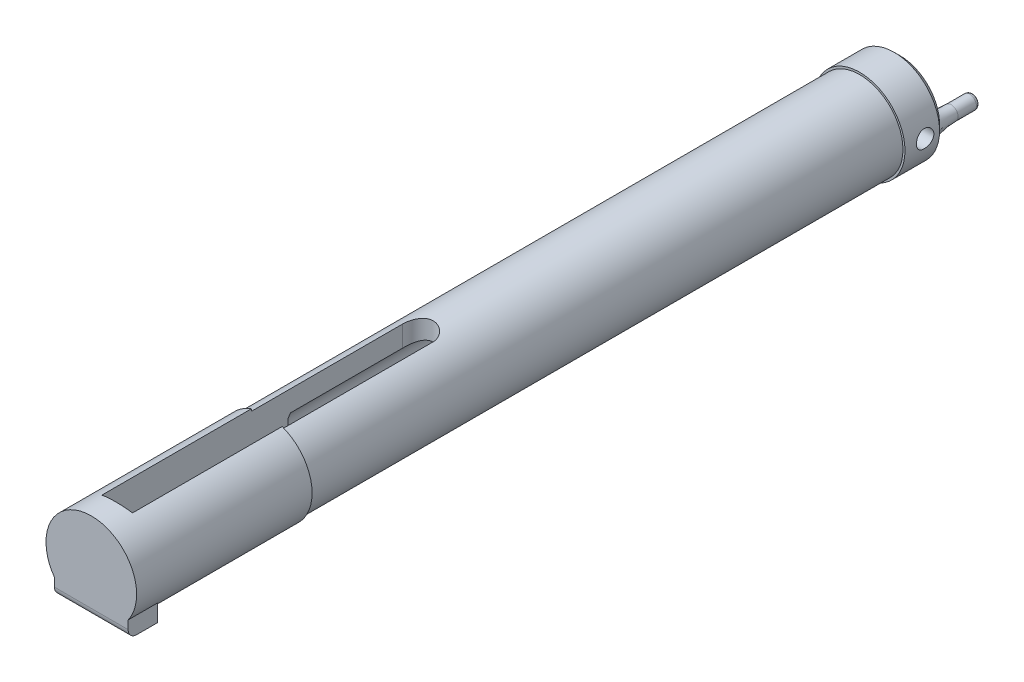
SolidWorks part; units mm, degrees
ref_plane "Спереди" through (0, 0, 0) normal (0, 0, 1) x (1, 0, 0)
ref_plane "Сверху" through (0, 0, 0) normal (0, 1, 0) x (1, 0, 0)
ref_plane "Справа" through (0, 0, 0) normal (1, 0, 0) x (0, 0, -1)
sketch "Эскиз1" plane through (0, 0, 0) normal (1, 0, 0) x (0, 0, -1)
  line L0 (-107.9741, 0) -> (5.4684, 0) construction
  line L1 (-82.296, 0) -> (-82.296, 3.0321)
  line L2 (-81.8991, 3.429) -> (0, 3.429)
  line L3 (0, 3.429) -> (0, 5.4547)
  line L4 (-0.7937, 6.2484) -> (-5.5562, 6.2484)
  line L5 (-5.5562, 6.2484) -> (-5.5562, 5.969)
  line L6 (-5.5562, 5.969) -> (-87.3125, 5.969)
  line L7 (-87.3125, 5.969) -> (-87.3125, 6.2484)
  line L8 (-87.3125, 6.2484) -> (-111.506, 6.2484)
  line L9 (-111.506, 6.2484) -> (-111.506, 0)
  line L10 (-111.506, 0) -> (-82.296, 0)
  line L11 (0, 5.4547) -> (-0.7937, 6.2484)
  line L12 (-82.296, 3.0321) -> (-81.8991, 3.429)
  point P4 (-82.296, 3.429)
  point P7 (0, 6.2484)
  dimension "D1" = 6.858
  dimension "D2" = 11.938
  dimension "D3" = 12.4968
  dimension "D4" = 5.5562
  dimension "D5" = 82.296
  dimension "D6" = 87.3125
  dimension "D7" = 111.506
revolve "Повернуть1" add sketch "Эскиз1" angle 360 about L0
sketch "Эскиз2" plane through (0, 0, 0) normal (1, 0, 0) x (0, 0, -1)
  line L0 (-111.506, -2.3468) -> (-107.4674, -2.3468)
  line L1 (-107.4674, -2.3468) -> (-107.4674, -5.9944)
  line L2 (-107.4674, -5.9944) -> (-110.3154, -5.9944)
  line L3 (-111.506, -2.3468) -> (-111.506, -4.8038)
  line L4 (-111.506, 6.2484) -> (-111.506, -6.2484) construction
  arc A0 (-110.3154, -5.9944) -> (-111.506, -4.8038) centre (-110.3154, -4.8038) cw
  dimension "D3" = 1.1906
  dimension "D1" = 5.9944
  dimension "D2" = 4.0386
sketch "Эскиз3" plane through (0, 0, 0) normal (1, 0, 0) x (0, 0, -1)
  line L0 (-89.0828, -6.2484) -> (-111.506, -6.2484)
  line L1 (-111.506, -6.2484) -> (-87.3125, -6.2484) construction
  line L2 (-111.506, -6.2484) -> (-111.506, -4.7498)
  line L3 (-111.506, -4.7498) -> (-93.1799, -4.7498)
  arc A0 (-93.1799, -4.7498) -> (-89.0828, -6.2484) centre (-93.1799, -11.0998) cw
  dimension "D1" = 6.35
  dimension "D2" = 18.3261
  dimension "D3" = 4.7498
extrude "Вырез-Вытянуть1" cut sketch "Эскиз3" against normal mid plane 10.16
extrude "Бобышка-Вытянуть1" add sketch "Эскиз2" along normal mid plane 10.16
sketch "Эскиз4" plane through (0, 0, 0) normal (0, 1, 0) x (1, 0, 0)
  line L0 (0, 0) -> (0, -64.3636) construction
  line L1 (2.1209, -66.4845) -> (2.1209, -106.2736)
  line L2 (2.1209, -106.2736) -> (-2.1209, -106.2736)
  line L3 (-2.1209, -106.2736) -> (-2.1209, -66.4845)
  arc A0 (2.1209, -66.4845) -> (-2.1209, -66.4845) centre (0, -66.4845) ccw
  dimension "D1" = 41.91
  dimension "D2" = 4.2418
  dimension "D3" = 106.2736
extrude "Вырез-Вытянуть2" cut sketch "Эскиз4" against normal mid plane 22.86
sketch "Эскиз5" plane through (0, 0, 0) normal (1, 0, 0) x (0, 0, -1)
  line L0 (-106.2736, 2.9928) -> (-108.1532, 6.2484)
  line L1 (-108.1532, 6.2484) -> (-106.2736, 6.2484)
  line L2 (-106.2736, 6.2484) -> (-106.2736, 2.9928)
  line L3 (-106.2736, 6.2484) -> (-111.506, 6.2484) construction
  line L4 (-106.2736, -4.7498) -> (-106.2736, 5.8774) construction
  dimension "D1" = 30
  dimension "D2" = 108.1532
extrude "Вырез-Вытянуть3" cut sketch "Эскиз5" against normal mid plane 4.2418
sketch "Эскиз6" plane through (0, 0, 0) normal (1, 0, 0) x (0, 0, -1)
  circle A0 centre (-2.7781, 0) radius 1.204
  dimension "D1" = 2.4079
  dimension "D2" = 2.7781
extrude "Вырез-Вытянуть4" cut sketch "Эскиз6" against normal mid plane 14.4018
sketch "Эскиз7" plane through (0, 0, 0) normal (1, 0, 0) x (0, 0, -1)
  line L0 (-3.8904, -4.8895) -> (10.2362, -4.8895) construction
  line L1 (9.5959, -3.937) -> (7.0612, -3.937)
  line L2 (10.2362, -4.8895) -> (-0.7937, -4.8895)
  line L3 (-0.7937, -4.8895) -> (-0.7937, -1.5181)
  line L4 (0, -1.5181) -> (-0.7937, -1.5181)
  line L5 (0, -5.4547) -> (0, 5.4547) construction
  line L6 (-0.7937, 6.2484) -> (-0.7937, -6.2484) construction
  line L7 (0, -3.429) -> (0, 3.429) construction
  arc A0 (10.2362, -4.8895) -> (10.0212, -4.1672) centre (8.9154, -4.8895) ccw
  arc A1 (0.2349, -1.9464) -> (7.0612, -3.937) centre (7.0612, 8.763) ccw
  arc A2 (0.2349, -1.9464) -> (0, -1.5181) centre (0.508, -1.5181) cw
  arc A3 (10.0212, -4.1672) -> (9.5959, -3.937) centre (9.5959, -4.445) ccw
  dimension "D3" = 1.3208
  dimension "D4" = 12.7
  dimension "D7" = 0.508
  dimension "D8" = 0.508
  dimension "D1" = 10.2362
  dimension "D2" = 4.8895
  dimension "D5" = 3.175
  dimension "D6" = 1.905
revolve "Повернуть2" add sketch "Эскиз7" angle 360 about L0
sketch "Эскиз8" plane through (0, 0, 5.5562) normal (0, 0, 1) x (1, 0, 0)
  circle A0 centre (0, 0) radius 3.429
  circle A1 centre (0, 0) radius 6.2484
  circle A2 centre (0, 0) radius 8.2609
  arc A3 (2.363, -2.4848) -> (-2.363, -2.4848) centre (0, 0) ccw construction
  arc A4 (3.3493, -5.2749) -> (-3.3493, -5.2749) centre (0, 0) ccw construction
  arc A5 (-3.3493, -5.2749) -> (3.3493, -5.2749) centre (0, -4.8895) ccw construction
extrude "Вырез-Вытянуть5" cut sketch "Эскиз8" against normal through all contours A2 M2 | A0
